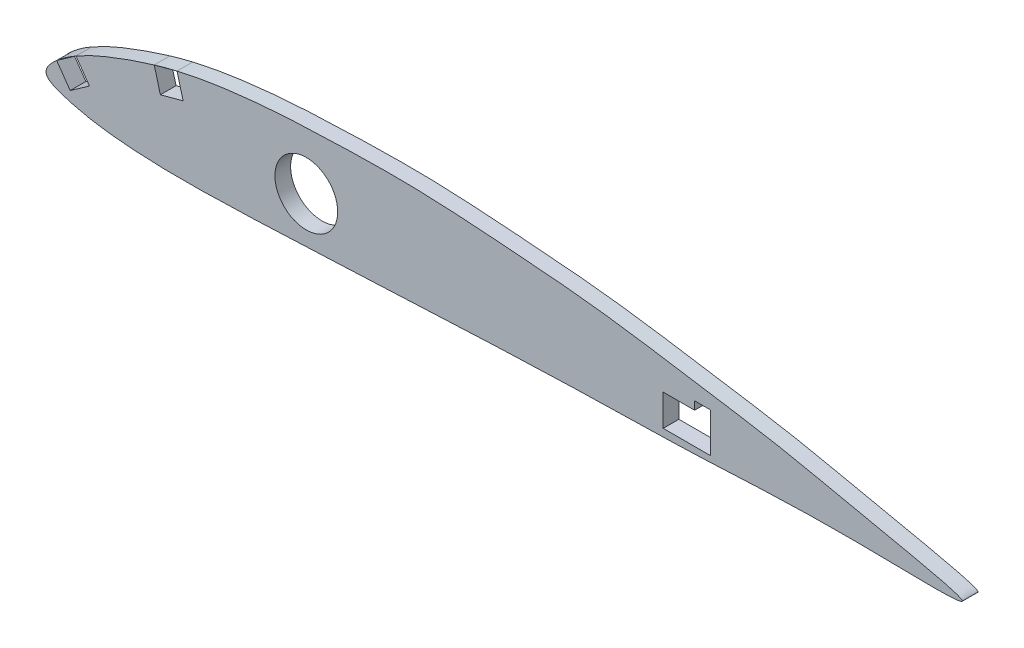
SolidWorks part; units mm, degrees
ref_plane "Front Plane" through (0, 0, 0) normal (0, 0, 1) x (1, 0, 0)
ref_plane "Top Plane" through (0, 0, 0) normal (0, 1, 0) x (1, 0, 0)
ref_plane "Right Plane" through (0, 0, 0) normal (1, 0, 0) x (0, 0, -1)
sketch3d "3DSketch1"
  spline S1 degree 3 poles (4.7991, -2.85, 0) (-1.7732, -0.7793, 0) (2.1132, 3.216, 0) (5.187, 5.4175, 0) (9.1709, 7.5628, 0) (16.8003, 10.6662, 0) (26.0552, 13.619, 0) (37.0104, 15.371, 0) (46.2955, 16.2976, 0) (58.6549, 16.8156, 0) (74.1198, 17.2542, 0) (92.629, 15.9551, 0) (111.2718, 14.5025, 0) (129.4917, 11.5838, 0) (149.0366, 8.5959, 0) (163.9526, 5.0868, 0) (195.7039, -1.2026, 0) (154.621, 0.2445, 0) (136.755, -1.3905, 0) (98.1871, -1.9985, 0) (68.0387, -3.6413, 0) (36.9982, -4.9943, 0) (21.7435, -5.2444, 0) (10.5153, -4.1569, 0) (4.7991, -2.85, 0) (-1.7732, -0.7793, 0) (2.1132, 3.216, 0) knots -0.051806 -0.027094 -0.014492 0 0.01056 0.018211 0.03221 0.045525 0.084069 0.108974 0.133649 0.158233 0.207343 0.256523 0.305826 0.355445 0.405214 0.45539 0.506007 0.555122 0.65337 0.70249 0.849939 0.899083 0.948194 0.972906 0.985508 1 1.01056 1.018211 1.03221 only from (0, 0, 0) to (0, 0, 0)
  dimension "D1" = 185.25
extrude "Boss-Extrude1" add sketch "3DSketch1" along direction (0, 0, 1) on the side of the normal blind 3.175
sketch "Sketch1" plane through (0, 0, 3.175) normal (0, 0, 1) x (1, 0, 0)
  line L0 (0, 0) -> (185.25, 0) construction
  line L1 (92.625, 0) -> (92.625, 5) construction
  line L2 (92.625, 5) -> (52.625, 5) construction
  line L3 (2.1575, 3.1038) -> (6.0587, 5.8354)
  line L4 (131.132, 8) -> (134.307, 8)
  line L5 (131.132, 8) -> (131.132, 6.35)
  line L6 (131.132, 0) -> (134.307, 0)
  line L7 (134.307, 8) -> (134.307, 0)
  line L8 (124.782, 6.35) -> (131.132, 6.35)
  line L9 (124.782, 6.35) -> (124.782, 0)
  line L10 (124.782, 0) -> (131.132, 0)
  line L11 (2.1575, 3.1038) -> (4.8891, -0.7974)
  line L12 (6.0587, 5.8354) -> (8.7903, 1.9342)
  line L13 (4.8891, -0.7974) -> (8.7903, 1.9342)
  line L14 (21.8878, 12.1771) -> (26.488, 13.4097)
  line L15 (21.8878, 12.1771) -> (23.1204, 7.5769)
  line L16 (26.488, 13.4097) -> (27.7206, 8.8095)
  line L17 (23.1204, 7.5769) -> (27.7206, 8.8095)
  circle A0 centre (52.625, 5) radius 6.35
  spline S0 degree 3 poles (2.1132, 3.216) (-1.7732, -0.7793) (4.7991, -2.85) (10.5153, -4.1569) (21.7435, -5.2444) (36.9982, -4.9943) (68.0387, -3.6413) (98.1871, -1.9985) (136.755, -1.3905) (154.621, 0.2445) (195.7039, -1.2026) (163.9526, 5.0868) (149.0366, 8.5959) (129.4917, 11.5838) (111.2718, 14.5025) (92.629, 15.9551) (74.1198, 17.2542) (58.6549, 16.8156) (46.2955, 16.2976) (37.0104, 15.371) (26.0552, 13.619) (16.8003, 10.6662) (9.1709, 7.5628) (5.187, 5.4175) (2.1132, 3.216) (-1.7732, -0.7793) (4.7991, -2.85) knots -0.03221 -0.018211 -0.01056 0 0.014492 0.027094 0.051806 0.100917 0.150061 0.29751 0.34663 0.444878 0.493993 0.54461 0.594786 0.644555 0.694174 0.743477 0.792657 0.841767 0.866351 0.891026 0.915931 0.954475 0.96779 0.981789 0.98944 1 1.014492 1.027094 1.051806 only from (0, 0) to (0, 0) construction
  dimension "D3" = 41.682
  dimension "D1" = 5
  dimension "D2" = 40
  dimension "D4" = 3.175
  dimension "D5" = 8
  dimension "D6" = 6.35
  dimension "D7" = 6.35
  dimension "D8" = 4.7625
  dimension "D9" = 4.7625
  dimension "D10" = 55
  dimension "D11" = 4.7625
  dimension "D12" = 4.7625
  dimension "D13" = 75
extrude "Cut-Extrude1" cut sketch "Sketch1" against normal blind 10
